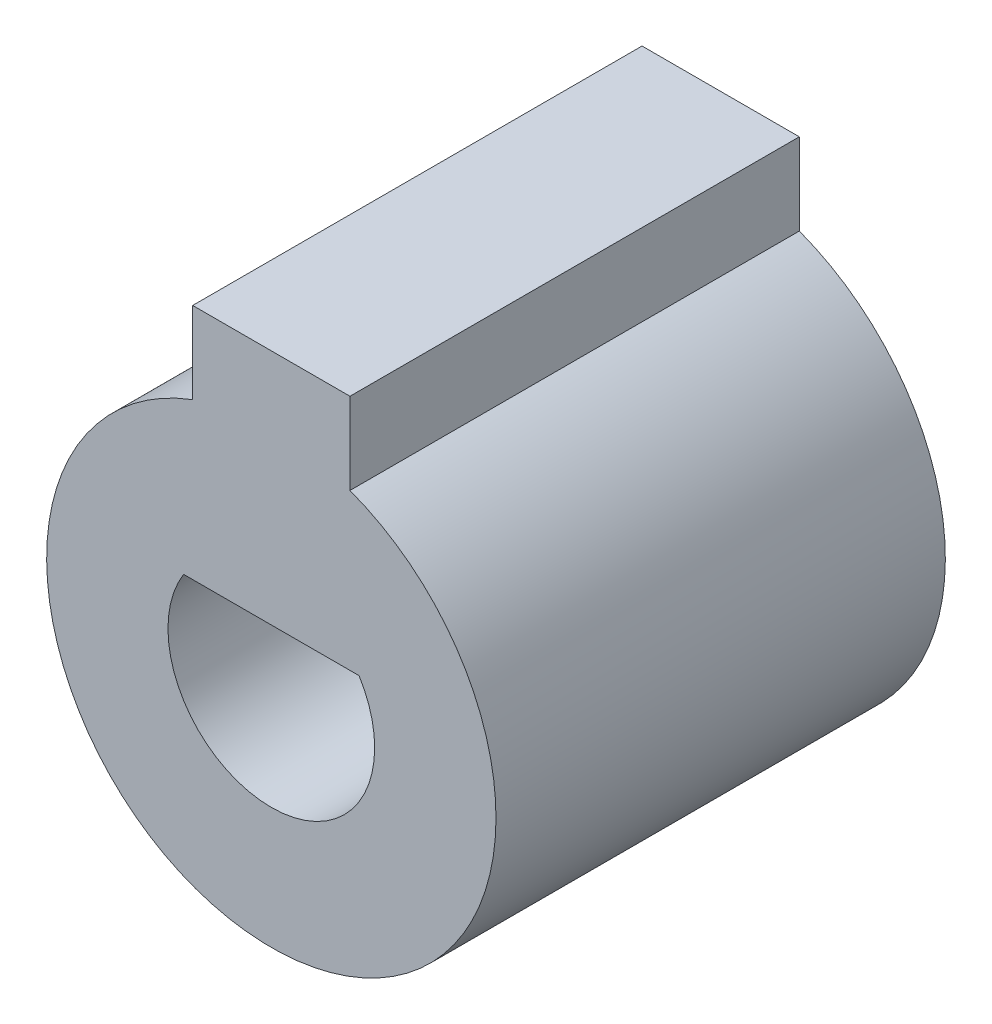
SolidWorks part; units mm, degrees
ref_plane "Front Plane" through (0, 0, 0) normal (0, 0, 1) x (1, 0, 0)
ref_plane "Top Plane" through (0, 0, 0) normal (0, 1, 0) x (1, 0, 0)
ref_plane "Right Plane" through (0, 0, 0) normal (1, 0, 0) x (0, 0, -1)
sketch "Sketch2" plane through (0, 0, 0) normal (0, 0, 1) x (1, 0, 0)
  line L0 (1.952, 1.2165) -> (-1.952, 1.2165)
  line L1 (0, 0) -> (1.75, 0)
  line L2 (0, 0) -> (0, 6.5)
  line L3 (0, 6.5) -> (1.75, 6.5)
  line L4 (1.75, 0) -> (1.75, 6.5)
  line L5 (0, 0) -> (-1.75, 0)
  line L6 (0, 0) -> (0, 6.5)
  line L7 (0, 6.5) -> (-1.75, 6.5)
  line L8 (-1.75, 0) -> (-1.75, 6.5)
  line L9 (-1.75, 6.5) -> (1.75, 6.5)
  line L10 (-1.75, 6.5) -> (-1.75, 1.2165)
  line L11 (-1.75, 1.2165) -> (1.75, 1.2165)
  line L12 (1.75, 6.5) -> (1.75, 1.2165)
  circle A0 centre (0, 0) radius 5
  circle A1 centre (0, 0) radius 2.3
  dimension "D1" = 10
  dimension "D2" = 4.6
  dimension "D3" = 6.5
  dimension "D4" = 1.75
  dimension "D5" = 1.75
  dimension "D6" = 1.2165
extrude "Boss-Extrude1" add sketch "Sketch2" along normal blind 10 contours A0 L12 L3 L6 | A0 L6 L7 L10 | A1 L10 A0 L12 | A1 L6 A0 L10 | A1 L12 A0 L6 | L4 A1 L2 L0 | L2 A1 L8 L0 | L8 A1 L0 | L0 A1 L4
